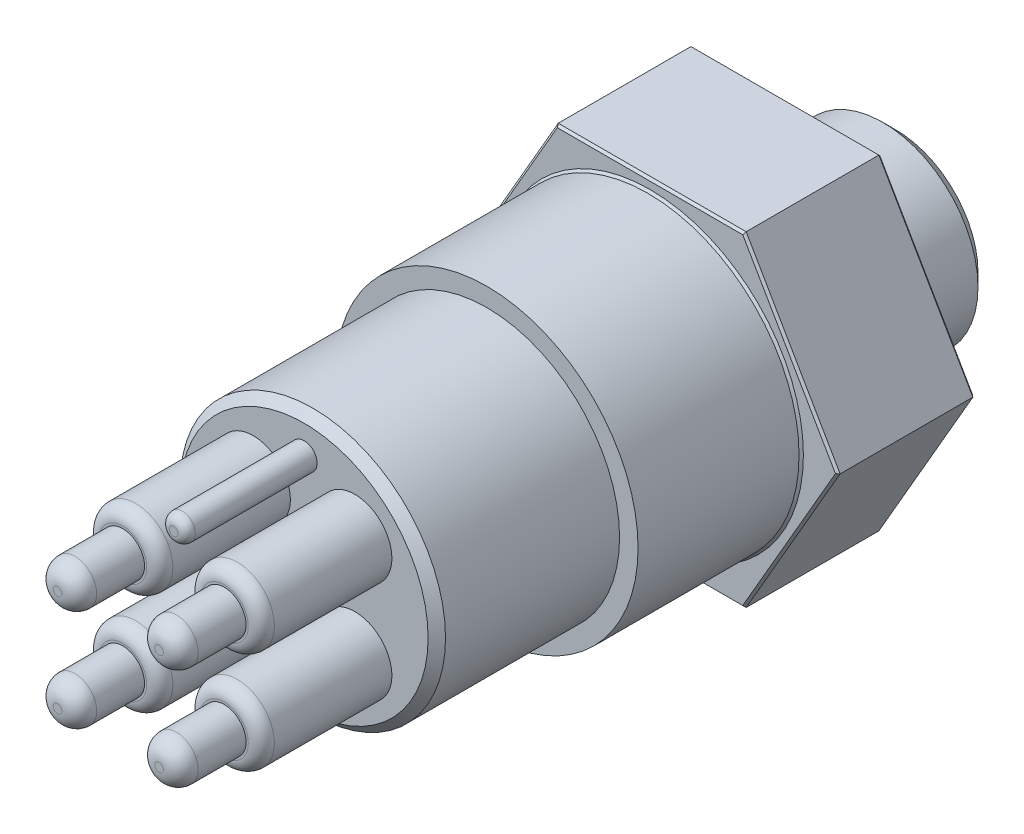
SolidWorks part; units mm, degrees
ref_plane "Front" through (0, 0, 0) normal (0, 0, 1) x (1, 0, 0)
ref_plane "Top" through (0, 0, 0) normal (0, 1, 0) x (1, 0, 0)
ref_plane "Right" through (0, 0, 0) normal (1, 0, 0) x (0, 0, -1)
sketch "Sketch1" plane through (0, 0, 0) normal (0, 0, 1) x (1, 0, 0)
  circle A0 centre (0, 0) radius 5.5562
  dimension "D1" = 11.1125
extrude "post" add sketch "Sketch1" against normal blind 6.35
chamfer "Chamfer1" distance 0.762 angle 45 1 edges at (5.5562, 0, -6.35)
sketch "Sketch2" plane through (0, 0, 0) normal (0, 0, 1) x (1, 0, 0)
  line L1 (-5.4846, 9.4996) -> (-10.9692, 0)
  line L2 (-10.9692, 0) -> (-5.4846, -9.4996)
  line L3 (-5.4846, -9.4996) -> (5.4846, -9.4996)
  line L4 (5.4846, -9.4996) -> (10.9692, 0)
  line L5 (10.9692, 0) -> (5.4846, 9.4996)
  line L6 (5.4846, 9.4996) -> (-5.4846, 9.4996)
  circle A0 centre (0, 0) radius 9.4996 construction
  dimension "D1" = 18.9992
extrude "hex" add sketch "Sketch2" along normal blind 8.001
sketch "Sketch5" plane through (0, 0, 8.001) normal (0, 0, 1) x (1, 0, 0)
  circle A0 centre (0, 0) radius 8.8265
  dimension "D1" = 17.653
extrude "Extrude1" add sketch "Sketch5" along normal blind 9.525
chamfer "Chamfer2" distance 0.127 angle 45 12 edges at (8.2269, 4.7498, 0) (0, 9.4996, 8.001) (-8.2269, 4.7498, 8.001) (-8.2269, -4.7498, 8.001) (0, -9.4996, 8.001) (8.2269, -4.7498, 8.001) (8.2269, 4.7498, 8.001) (-8.8265, 0, 8.001) (0, 9.4996, 0) (-8.2269, -4.7498, 0) (0, -9.4996, 0) (8.2269, -4.7498, 0)
sketch "Sketch3" plane through (0, 0, 17.526) normal (0, 0, 1) x (1, 0, 0)
  circle A0 centre (0, 0) radius 7.747
  dimension "D1" = 15.494
extrude "rubber" add sketch "Sketch3" along normal blind 10.668
chamfer "Chamfer3" distance 0.508 angle 45 1 edges at (7.747, 0, 28.194)
sketch "Sketch4" plane through (0, 0, 28.194) normal (0, 0, 1) x (1, 0, 0)
  line L0 (0, 6.6112) -> (0, -6.1992) construction
  line L3 (0, 0) -> (7.506, 7.506) construction
  line L4 (0, 0) -> (-6.8526, -6.8526) construction
  line L5 (0, 0) -> (7.6052, -7.6052) construction
  line L6 (0, 0) -> (-7.5761, 7.5761) construction
  circle A0 centre (0, 0) radius 4.191 construction
  circle A1 centre (0, 5.588) radius 0.762
  circle A3 centre (2.9635, -2.9635) radius 2.159
  circle A4 centre (-2.9635, 2.9635) radius 2.159
  circle A5 centre (-2.9635, -2.9635) radius 2.159
  circle A6 centre (2.9635, 2.9635) radius 2.159
  dimension "D1" = 8.382
  dimension "D2" = 45
  dimension "D3" = 4.318
  dimension "D4" = 4.318
  dimension "D5" = 4.318
  dimension "D6" = 4.318
  dimension "D7" = 1.524
  dimension "D8" = 5.588
extrude "PINS" add sketch "Sketch4" along normal blind 7.62
sketch "Sketch6" plane through (0, 0, 35.814) normal (0, 0, 1) x (1, 0, 0)
  circle A0 centre (-2.9635, 2.9635) radius 1.27
  circle A1 centre (-2.9635, -2.9635) radius 1.27
  circle A2 centre (2.9635, 2.9635) radius 1.27
  circle A3 centre (2.9635, -2.9635) radius 1.27
  dimension "D1" = 2.54
  dimension "D2" = 2.54
  dimension "D3" = 2.54
  dimension "D4" = 2.54
extrude "pin tips" add sketch "Sketch6" along normal blind 3.81
fillet "pin tip radius" radius 1.016 4 edges at (4.2335, 2.9635, 39.624) (4.2335, -2.9635, 39.624) (-1.6935, -2.9635, 39.624) (-1.6935, 2.9635, 39.624)
fillet "guide pit tip" radius 0.508 1 edges at (0.762, 5.588, 35.814)
fillet "Fillet3" radius 0.762 4 edges at (5.1225, -2.9635, 35.814) (5.1225, 2.9635, 35.814) (-0.8045, -2.9635, 35.814) (-0.8045, 2.9635, 35.814)
